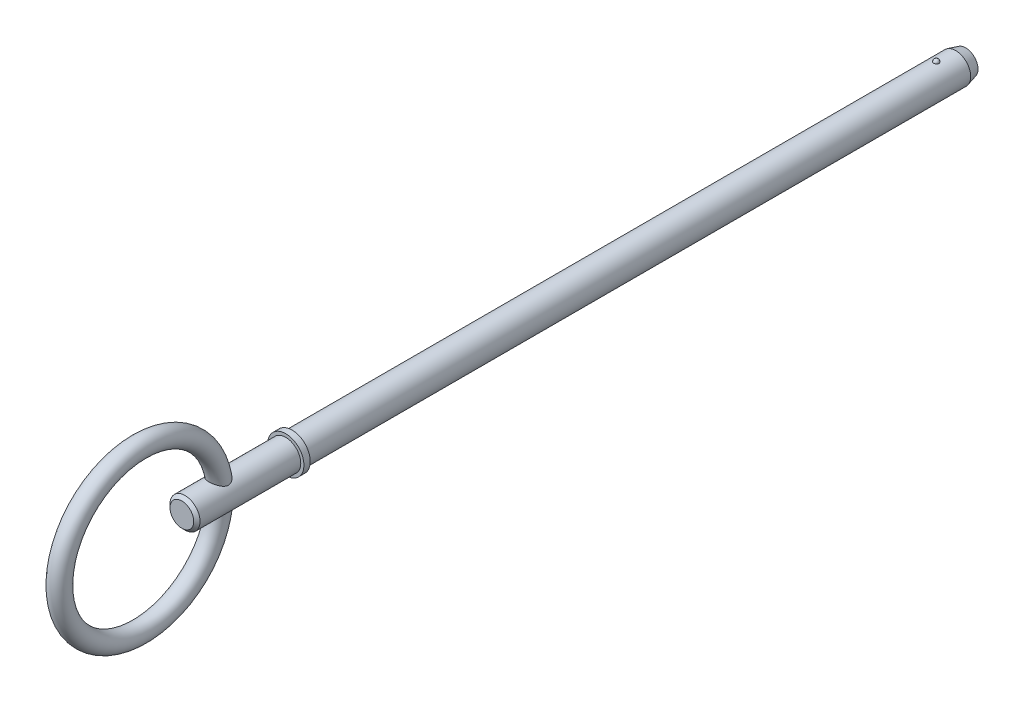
SolidWorks part; units mm, degrees
ref_plane "Front Plane" through (0, 0, 0) normal (0, 0, 1) x (1, 0, 0)
ref_plane "Top Plane" through (0, 0, 0) normal (0, 1, 0) x (1, 0, 0)
ref_plane "Right Plane" through (0, 0, 0) normal (1, 0, 0) x (0, 0, -1)
sketch "Sketch2" plane through (0, 0, 0) normal (0, 0, 1) x (1, 0, 0)
  circle A0 centre (0, 0) radius 2.38
  point P3 (0, 2.38)
  dimension "D1" = 4.76
extrude "Boss-Extrude1" add sketch "Sketch2" along normal blind 101.6
sketch "Sketch3" plane through (0, 0, 0) normal (0, 0, -1) x (-1, 0, 0)
  circle A0 centre (0, 0) radius 2.38
  dimension "D1" = 4.76
extrude "Boss-Extrude2" add sketch "Sketch3" along normal blind 5.08
chamfer "Chamfer1" distance 1.586 angle 15 1 edges at (-2.38, 0, -5.08)
sketch "Sketch18" plane through (0, 0, 0) normal (1, 0, 0) x (0, 0, -1)
  line L0 (3.494, 2.38) -> (-101.6, 2.38) construction
  line L1 (0.42, 2.8) -> (0.42, 1.96)
  line L2 (-101.6, -2.38) -> (3.494, -2.38) construction
  arc A0 (0.42, 2.8) -> (0.42, 1.96) centre (0.42, 2.38) ccw
  point P4 (0, 2.38)
  dimension "D1" = 5.18
revolve "Revolve1" add sketch "Sketch18" angle 360 about L1
sketch "Sketch19" plane through (0, 0, 0) normal (1, 0, 0) x (0, 0, -1)
  line L0 (-33.7288, 0) -> (-46.4542, 0) construction
sketch "Sketch20" plane through (0, 0, 0) normal (1, 0, 0) x (0, 0, -1)
  line L0 (-101.6, 0) -> (-101.6, 2.88)
  line L1 (-101.6, 2.38) -> (-101.6, -2.38) construction
  line L2 (-101.6, 2.88) -> (-102.6, 2.88)
  line L3 (-102.6, 2.88) -> (-102.6, 0)
  line L4 (-33.7288, 0) -> (-46.4542, 0) construction
  line L5 (-102.6, 0) -> (-101.6, 0)
  dimension "D1" = 2.88
  dimension "D2" = 1
revolve "Revolve2" add sketch "Sketch20" angle 360 about L0
sketch "Sketch21" plane through (0, 0, 101.6) normal (0, 0, -1) x (-1, 0, 0)
  circle A0 centre (0, 0) radius 2.38
  dimension "D1" = 4.76
extrude "Boss-Extrude3" add sketch "Sketch21" against normal blind 17.45
chamfer "Chamfer2" distance 0.5 angle 45 1 edges at (-2.38, 0, 119.05)
sketch "Sketch23" plane through (0, 0, 0) normal (1, 0, 0) x (0, 0, -1)
  line L0 (-119.05, 1.88) -> (-119.05, -1.88) construction
  circle A0 centre (-125.75, 0) radius 12.7
  point P2 (-113.05, 0)
  dimension "D1" = 25.4
  dimension "D2" = 6
sketch "Sketch24" plane through (0, 0, 0) normal (0, 1, 0) x (1, 0, 0)
  circle A0 centre (0, -113.05) radius 1.5
  dimension "D1" = 3
sweep "Sweep1" add profiles "Sketch24" path "Sketch23"
